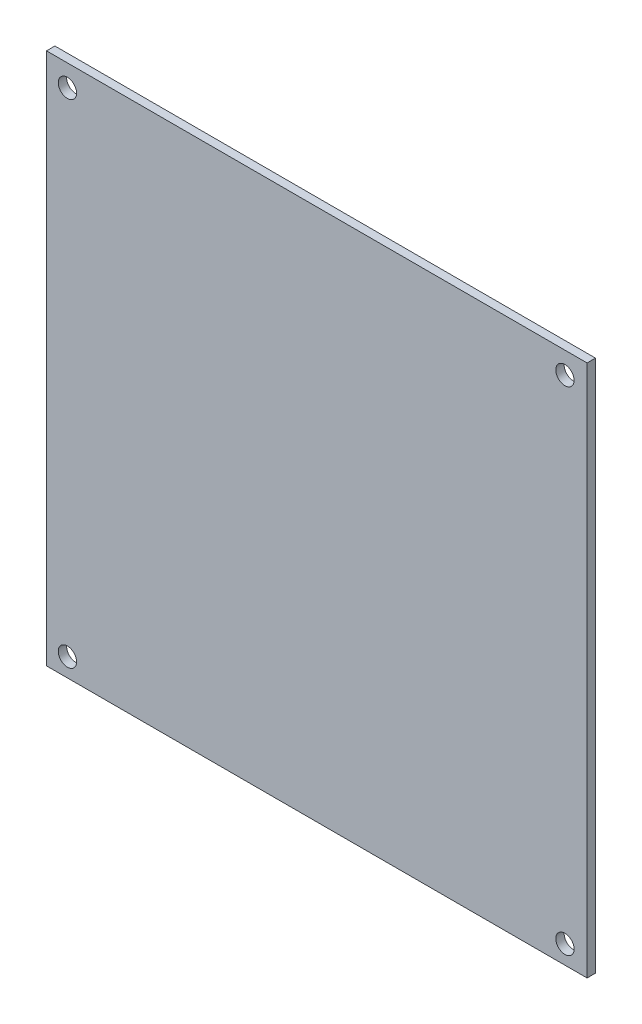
SolidWorks part; units mm, degrees
ref_plane "Front Plane" through (0, 0, 0) normal (0, 0, 1) x (1, 0, 0)
ref_plane "Top Plane" through (0, 0, 0) normal (0, 1, 0) x (1, 0, 0)
ref_plane "Right Plane" through (0, 0, 0) normal (1, 0, 0) x (0, 0, -1)
sketch "Sketch1" plane through (0, 0, 0) normal (0, 0, 1) x (1, 0, 0)
  line L1 (0, 0) -> (228.6, 0)
  line L2 (0, 0) -> (0, 101.6)
  line L3 (0, 101.6) -> (228.6, 101.6)
  line L4 (228.6, 0) -> (228.6, 101.6)
  dimension "D1" = 101.6
  dimension "D2" = 228.6
extrude "Extrude1" add sketch "Sketch1" along normal blind 1.6
sketch "Sketch3" plane through (0, 0, 1.6) normal (0, 0, 1) x (1, 0, 0)
  line L0 (0, 101.6) -> (0, 0) construction
  line L1 (228.6, 101.6) -> (0, 101.6) construction
  line L2 (228.6, 0) -> (228.6, 101.6) construction
  line L3 (0, 0) -> (228.6, 0) construction
  circle A0 centre (3.75, 97.85) radius 1.875
  circle A1 centre (224.85, 97.85) radius 1.875
  circle A2 centre (224.85, 3.75) radius 1.875
  circle A3 centre (3.75, 3.75) radius 1.875
  dimension "D1" = 3.75
  dimension "D2" = 3.75
  dimension "D3" = 3.75
  dimension "D4" = 3.75
  dimension "D5" = 3.75
extrude "Extrude3" cut sketch "Sketch3" against normal through all
sketch "Sketch4" plane through (0, 0, 1.6) normal (0, 0, 1) x (1, 0, 0)
  line L1 (94.1032, 107.3222) -> (197.2097, 107.3222)
  line L2 (94.1032, 107.3222) -> (94.1032, -1.7885)
  line L3 (94.1032, -1.7885) -> (197.2097, -1.7885)
  line L4 (197.2097, 107.3222) -> (197.2097, -1.7885)
extrude "Cut-Extrude1" cut sketch "Sketch4" against normal through all flip side to cut
sketch "Sketch5" plane through (0, 0, 1.6) normal (0, 0, 1) x (1, 0, 0)
  circle A0 centre (98.0873, 97.4762) radius 1.75
  circle A1 centre (192.9875, 97.4762) radius 1.75
  circle A2 centre (192.9875, 3.5285) radius 1.75
  circle A3 centre (98.0873, 3.5285) radius 1.75
extrude "Cut-Extrude2" cut sketch "Sketch5" against normal through all
